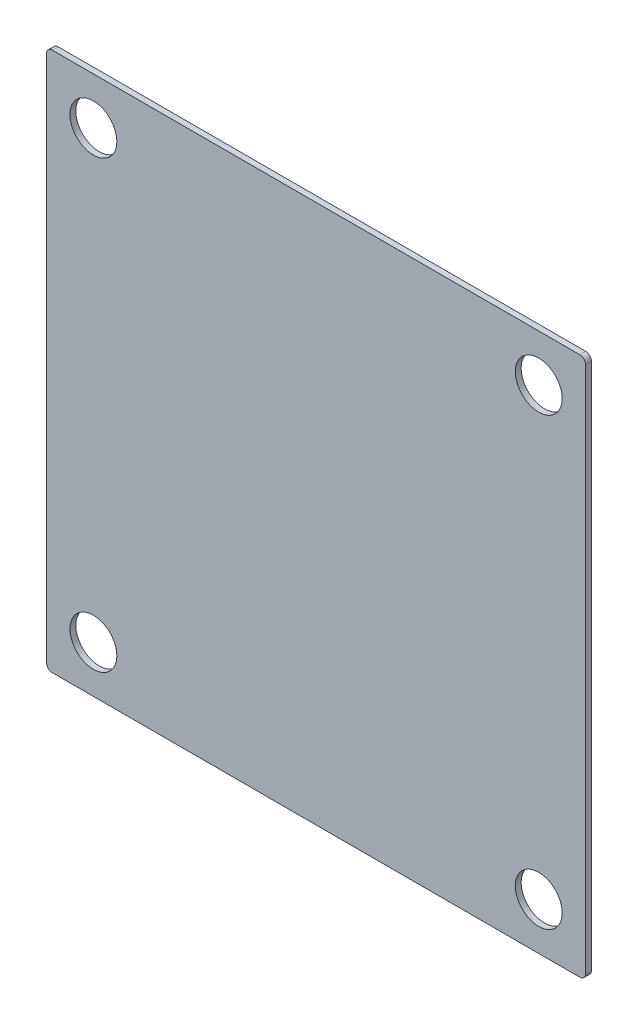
SolidWorks part; units mm, degrees
ref_plane "Front Plane" through (0, 0, 0) normal (0, 0, 1) x (1, 0, 0)
ref_plane "Top Plane" through (0, 0, 0) normal (0, 1, 0) x (1, 0, 0)
ref_plane "Right Plane" through (0, 0, 0) normal (1, 0, 0) x (0, 0, -1)
sketch "Sketch1" plane through (0, 0, 0) normal (0, 0, 1) x (1, 0, 0)
  line L0 (-76.2, 76.2) -> (-76.2, -76.2) construction
  line L1 (-71.4375, 73.025) -> (71.4375, 73.025)
  line L2 (-73.025, 71.4375) -> (-73.025, -71.4375)
  line L3 (-71.4375, -73.025) -> (71.4375, -73.025)
  line L4 (73.025, 71.4375) -> (73.025, -71.4375)
  line L5 (76.2, 76.2) -> (-76.2, 76.2) construction
  circle A0 centre (-60.325, -60.325) radius 6.35 construction
  circle A1 centre (60.325, -60.325) radius 6.35 construction
  circle A2 centre (60.325, 60.325) radius 6.35 construction
  circle A3 centre (-60.325, 60.325) radius 6.35 construction
  circle A4 centre (-60.325, -60.325) radius 6.35
  circle A5 centre (60.325, -60.325) radius 6.35
  circle A6 centre (60.325, 60.325) radius 6.35
  circle A7 centre (-60.325, 60.325) radius 6.35
  arc A8 (-73.025, -71.4375) -> (-71.4375, -73.025) centre (-71.4375, -71.4375) ccw
  arc A9 (71.4375, -73.025) -> (73.025, -71.4375) centre (71.4375, -71.4375) ccw
  arc A10 (71.4375, 73.025) -> (73.025, 71.4375) centre (71.4375, 71.4375) cw
  arc A11 (-71.4375, 73.025) -> (-73.025, 71.4375) centre (-71.4375, 71.4375) ccw
  point P16 (0, 73.025)
  point P18 (-73.025, 0)
extrude "Boss-Extrude1" add sketch "Sketch1" along normal blind 1.5875
equation "\"D2@Sketch1\"=\"D1@Sketch1\""
